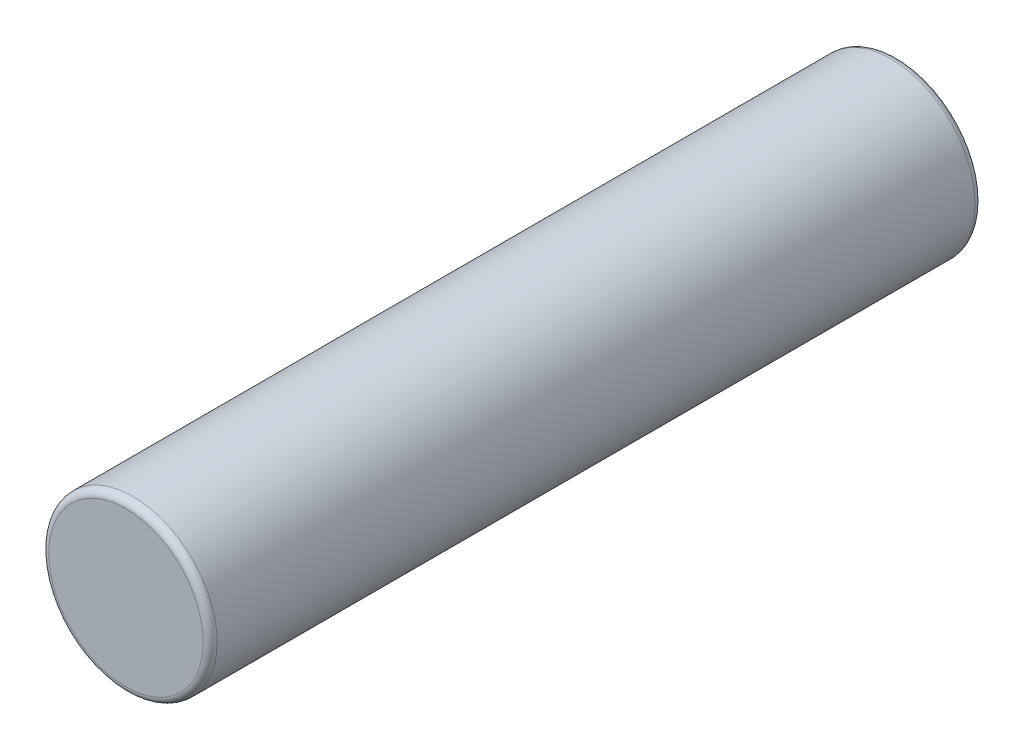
SolidWorks part; units mm, degrees
ref_plane "Piano frontale" through (0, 0, 0) normal (0, 0, 1) x (1, 0, 0)
ref_plane "Piano superiore" through (0, 0, 0) normal (0, 1, 0) x (1, 0, 0)
ref_plane "Piano destro" through (0, 0, 0) normal (1, 0, 0) x (0, 0, -1)
sketch "Schizzo1" plane through (0, 0, 0) normal (0, 0, 1) x (1, 0, 0)
  circle A0 centre (0, 0) radius 12
  dimension "D1" = 24
extrude "Estrusione-Estrusione1" add sketch "Schizzo1" along normal mid plane 110
fillet "Raccordo1" radius 1 2 edges at (12, 0, -55) (12, 0, 55)
sketch "Linee di piegatura1" [suppressed] plane through (0, 0, 0) normal (0, 1, 0) x (1, 0, 0)
sketch "Casella di contorno1" [suppressed] plane through (0, 0, 0) normal (0, 1, 0) x (1, 0, 0)
equation "\"Lam_vern\"= 2 * ( \"SW-Massa\" / \"SW-Densità\" ) / ( \"Spessore\" / 1000 )"
